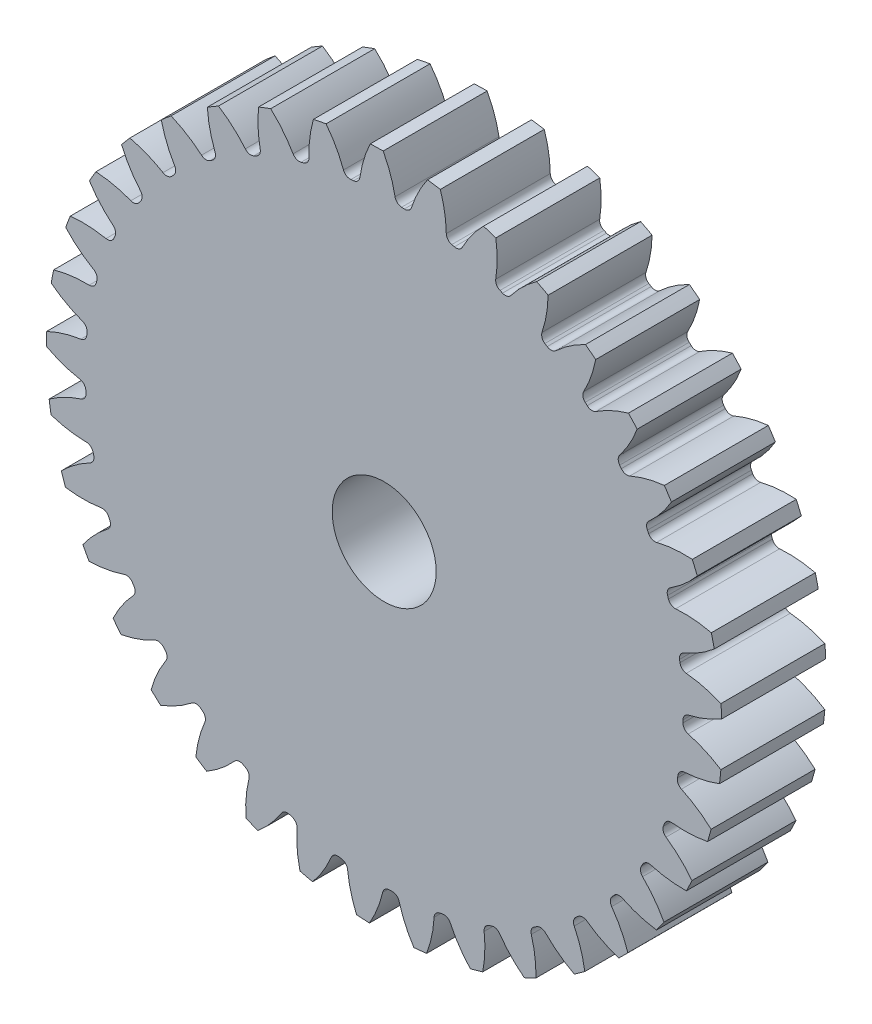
SolidWorks part; units mm, degrees
ref_plane "Front" through (0, 0, 0) normal (0, 0, 1) x (1, 0, 0)
ref_plane "Top" through (0, 0, 0) normal (0, 1, 0) x (1, 0, 0)
ref_plane "Right" through (0, 0, 0) normal (1, 0, 0) x (0, 0, -1)
sketch "Sketch3" plane through (0, 0, 0) normal (0, 0, 1) x (1, 0, 0)
  circle A0 centre (0, 0) radius 330.2
  dimension "od" = 660.4
extrude "gearBody" add sketch "Sketch3" along normal blind 101.6
sketch "Sketch2" plane through (0, 0, 0) normal (0, 0, 1) x (1, 0, 0)
  line L0 (0, 0) -> (271.9665, 112.6522) construction
  line L1 (329.3086, -28.6192) -> (0, 0) construction
  line L2 (0, 0) -> (36.3143, 0) construction
  line L3 (313.1911, 6.8794) -> (312.6523, -19.6101) construction
  line L5 (312.9217, -6.3654) -> (0, 0) construction
  line L7 (0, 0) -> (294.3744, 0) construction
  arc A0 (294.3712, 1.3626) -> (294.0723, -13.3325) centre (0, 0) ccw construction
  arc A1 (329.8591, 15.0008) -> (328.9762, -28.4026) centre (0, 0) ccw construction
  arc A2 (313.1911, 6.8794) -> (312.6523, -19.6101) centre (0, 0) ccw construction
  arc A3 (292.009, -7.2906) -> (292.0639, -4.5904) centre (0, 0) ccw
  arc A4 (329.3086, -28.6192) -> (297.0822, -14.1108) centre (267.1603, -123.619) ccw
  arc A5 (329.3086, -28.6192) -> (330.2, 15.2037) centre (0, 0) ccw
  arc A6 (330.2, 15.2037) -> (297.4103, 2.0178) centre (271.9665, 112.6522) cw
  arc A7 (292.0639, -4.5904) -> (297.4103, 2.0178) centre (298.9549, -4.6987) cw
  arc A8 (297.0822, -14.1108) -> (292.009, -7.2906) centre (298.8987, -7.4627) cw
  point P6 (330.2, 15.2037)
  point P22 (329.3086, -28.6192)
  dimension "baseDia" = 588.7488
  dimension "od" = 660.4
  dimension "pd" = 626.5333
  dimension "rd" = 584.2
  dimension "rFillet" = 6.8919
  dimension "pointX" = 330.2
  dimension "pointY" = 15.2037
  dimension "CTT" = 26.4896
  dimension "flankCenterAngle" = 22.5
extrude "toothCut" cut sketch "Sketch2" along normal through all
pattern_circular "CirPattern1" count 37 over 360 about axis through (0, 0, 0) along (0, 0, 1) of "toothCut"
sketch "hub1Dia" plane through (0, 0, 0) normal (0, 0, -1) x (-1, 0, 0)
  circle A0 centre (0, 0) radius 12.7
  dimension "hub1Dia" = 25.4
sketch "hub2Dia" plane through (0, 0, 101.6) normal (0, 0, 1) x (1, 0, 0)
  circle A0 centre (0, 0) radius 12.7
  dimension "hub2dia" = 25.4
sketch "boreDia" plane through (0, 0, 0) normal (0, 0, 1) x (1, 0, 0)
  circle A0 centre (0, 0) radius 50.8
  dimension "boreDia" = 101.6
extrude "bore" cut sketch "boreDia" against normal mid plane 25400
